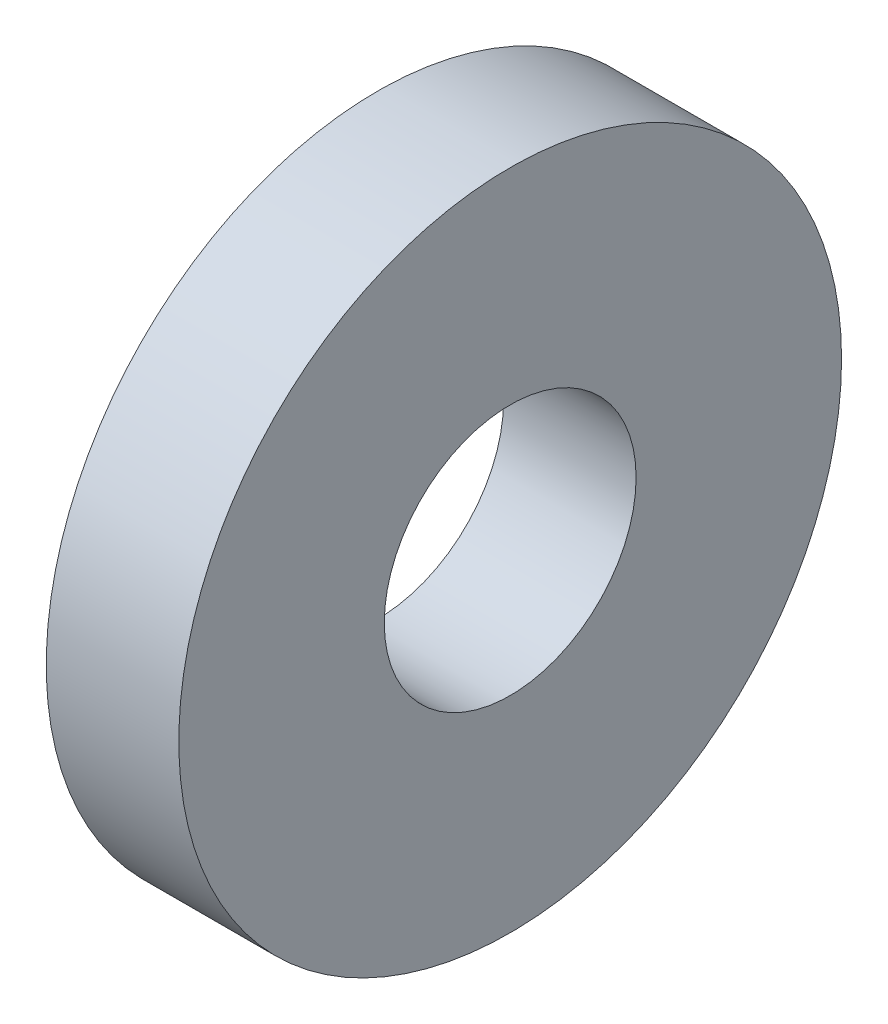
SolidWorks part; units mm, degrees
ref_plane "Plane1" through (0, 0, 0) normal (0, 0, 1) x (1, 0, 0)
ref_plane "Plane2" through (0, 0, 0) normal (0, 1, 0) x (1, 0, 0)
ref_plane "Plane3" through (0, 0, 0) normal (1, 0, 0) x (0, 0, -1)
sketch "Sketch1" plane through (0, 0, 0) normal (1, 0, 0) x (0, 0, -1)
  circle A0 centre (0, 0) radius 0.95
  circle A1 centre (0, 0) radius 2.5
  dimension "Insid_dia" = 1.9
  dimension "OutsideDia" = 5
extrude "Base-Extrude" add sketch "Sketch1" along normal blind 1
